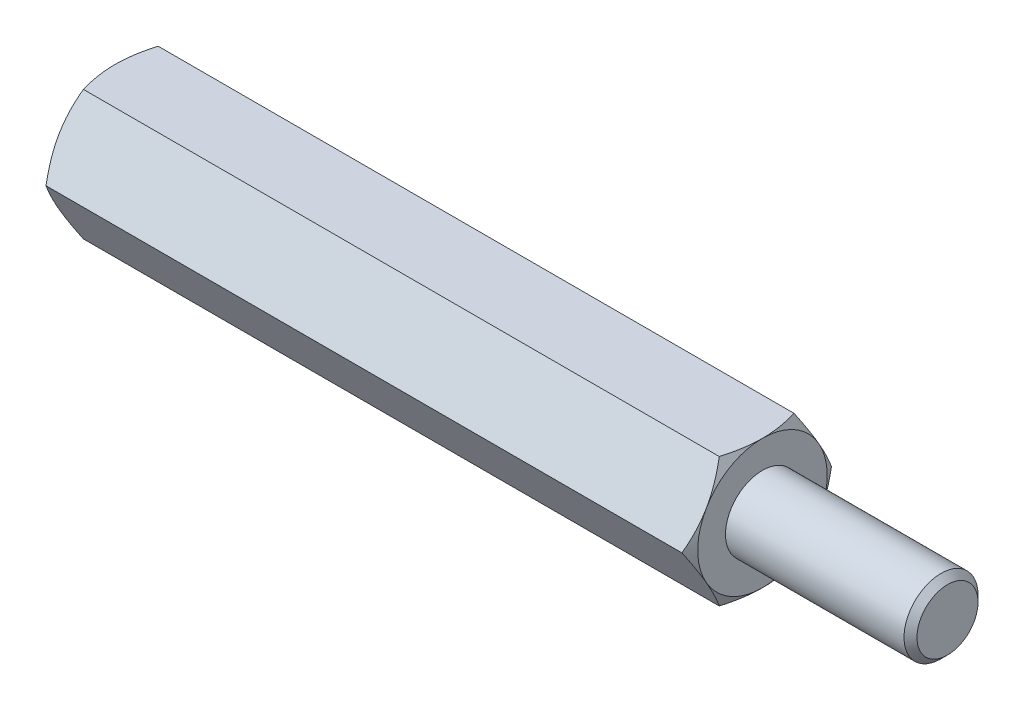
SolidWorks part; units mm, degrees
ref_plane "Front Plane" through (0, 0, 0) normal (0, 0, 1) x (1, 0, 0)
ref_plane "Top Plane" through (0, 0, 0) normal (0, 1, 0) x (1, 0, 0)
ref_plane "Right Plane" through (0, 0, 0) normal (1, 0, 0) x (0, 0, -1)
sketch "Sketch1" plane through (0, 0, 0) normal (1, 0, 0) x (0, 0, -1)
  line L1 (2.0207, 3.5) -> (-2.0207, 3.5)
  line L2 (-2.0207, 3.5) -> (-4.0415, 0)
  line L3 (-4.0415, 0) -> (-2.0207, -3.5)
  line L4 (-2.0207, -3.5) -> (2.0207, -3.5)
  line L5 (2.0207, -3.5) -> (4.0415, 0)
  line L6 (4.0415, 0) -> (2.0207, 3.5)
  circle A0 centre (0, 0) radius 3.5 construction
  dimension "D1" = 7
extrude "Extrude2" add sketch "Sketch1" along normal mid plane 35
sketch "Sketch2" plane through (0, 0, 0) normal (0, 0, 1) x (1, 0, 0)
  line L0 (-17.5, 3.5) -> (-16, 6.0981)
  line L1 (-17.5, 6.5) -> (-17.5, 3.5)
  line L3 (0, 0) -> (50000, 0) construction
  arc A0 (-16, 6.0981) -> (-17.5, 6.5) centre (-16.6962, 6.5) ccw
  dimension "D1" = 30
  dimension "D2" = 3
revolve "Cut-Revolve1" cut sketch "Sketch2" angle 360 about L3
mirror "Mirror1" about plane through (0, 0, 0) normal (1, 0, 0) of "Cut-Revolve1"
sketch "Sketch3" plane through (-17.5, 0, 0) normal (-1, 0, 0) x (0, 0, 1)
  circle A0 centre (0, 0) radius 1.65
  dimension "D1" = 3.3
extrude "Extrude3" cut sketch "Sketch3" against normal blind 10
sketch "Sketch4" plane through (0, 0, 0) normal (0, 0, 1) x (1, 0, 0)
  line L0 (-7.5, 0) -> (-7.5, 1.65)
  line L1 (17.1874, 0) -> (-17.1874, 0) construction
  line L2 (-7.5, 1.65) -> (-6.5474, 0)
  line L3 (-6.5474, 0) -> (-7.5, 0)
  line L4 (-17.5, 1.75) -> (-17.5, -1.75) construction
  point P4 (-17.5, 0)
  dimension "D1" = 30
  dimension "D2" = 1.65
  dimension "D3" = 10
revolve "Cut-Revolve2" cut sketch "Sketch4" angle 360 about L3
sketch "Sketch5" plane through (17.5, 0, 0) normal (1, 0, 0) x (0, 0, -1)
  circle A0 centre (0, 0) radius 2
  dimension "D1" = 4
extrude "Extrude4" add sketch "Sketch5" along normal blind 10
chamfer "Chamfer1" distance 0.35 angle 45 1 edges at (27.5, 0, -2)
equation "\"D2@Sketch4\" = \"D1@Sketch3\"/2"
